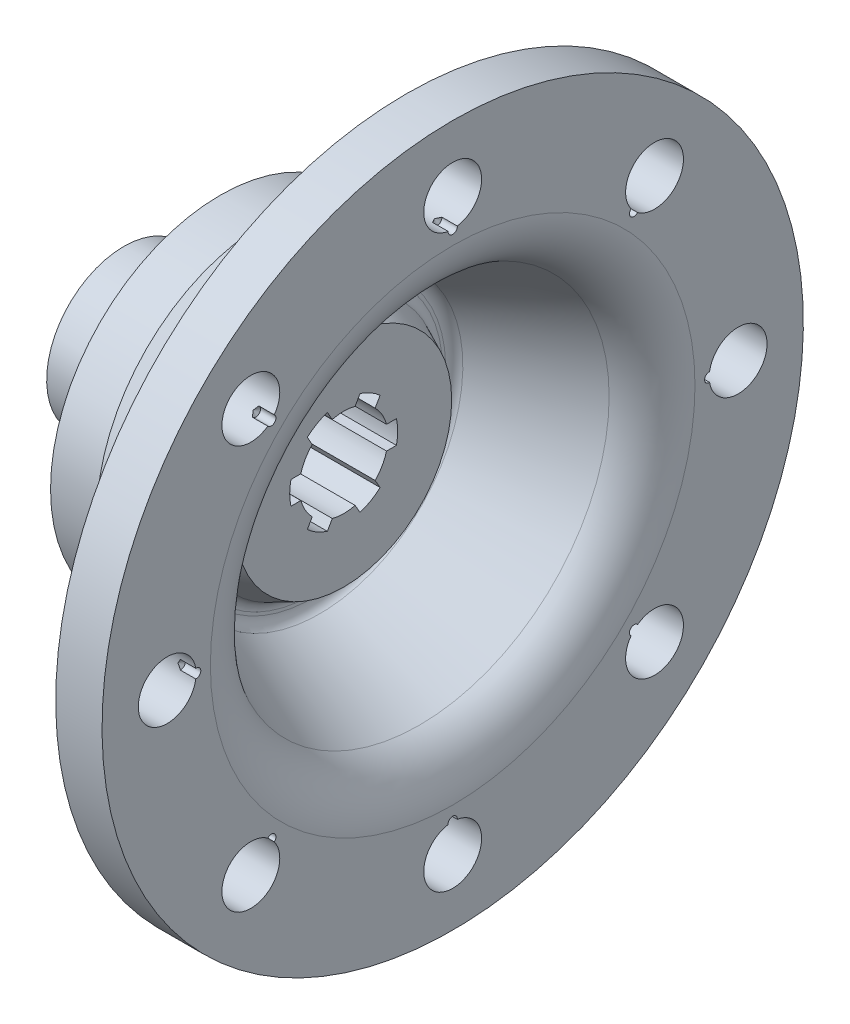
SolidWorks part; units mm, degrees
ref_plane "Face" through (0, 0, 0) normal (0, 0, 1) x (1, 0, 0)
ref_plane "Dessus" through (0, 0, 0) normal (0, 1, 0) x (1, 0, 0)
ref_plane "Droite" through (0, 0, 0) normal (1, 0, 0) x (0, 0, -1)
sketch "Esquisse1" plane through (0, 0, 0) normal (0, 0, 1) x (1, 0, 0)
  line L0 (0, 0) -> (0, 20)
  line L1 (0, 20) -> (15, 20)
  line L2 (15, 20) -> (15, 24)
  line L3 (15, 24) -> (25, 24)
  line L4 (25, 24) -> (25, 44)
  line L5 (25, 44) -> (37, 44)
  line L6 (37, 44) -> (73.2523, 60.9047)
  line L7 (73.2523, 60.9047) -> (73.2523, 90.9047)
  line L8 (73.2523, 90.9047) -> (85.2523, 90.9047)
  line L9 (85.2523, 90.9047) -> (85.2523, 53.2599)
  line L10 (85.2523, 53.2599) -> (49, 36.3552)
  line L11 (49, 36.3552) -> (49, 31.7305)
  line L12 (49, 31.7305) -> (57, 28)
  line L13 (57, 28) -> (57, 0)
  line L14 (57, 0) -> (0, 0)
  line L15 (49, 34.0428) -> (68.0279, 34.0428) construction
  dimension "D1" = 57
  dimension "D2" = 20
  dimension "D3" = 15
  dimension "D4" = 4
  dimension "D5" = 10
  dimension "D6" = 20
  dimension "D7" = 12
  dimension "D8" = 40
  dimension "D9" = 25
  dimension "D10" = 30
  dimension "D11" = 12
  dimension "D12" = 12
  dimension "D13" = 28
  dimension "D14" = 8
revolve "Révolution1" add sketch "Esquisse1" angle 360 about L14
sketch "Esquisse5" plane through (0, 0, 0) normal (-1, 0, 0) x (0, 0, 1)
  circle A0 centre (0, 0) radius 14
  dimension "D1" = 28
extrude "Enlèv. mat.-Extru.1" cut sketch "Esquisse5" against normal through all
hole_wizard "Trou taraudé M8x1.251" positions "Esquisse4" profile "Esquisse3" tap size "M8x1.25" standard "ISO"
sketch "Esquisse4" plane through (25, 0, 0) normal (-1, 0, 0) x (0, 0, 1)
  point P0 (0, 34)
  dimension "D1" = 34
sketch "Esquisse3" plane through (25, 34, 0) normal (0, 1, 0) x (0, 0, 1)
  line L0 (0, 0) -> (0, 20.7929)
  line L1 (0, 20.7929) -> (3.4, 18.75)
  line L2 (3.4, 18.75) -> (3.4, 15)
  line L3 (3.4, 15) -> (4, 15)
  line L4 (4, 15) -> (4, 0)
  line L5 (4, 0) -> (0, 0)
  line L10 (0, 20.7929) -> (-3.4, 18.75) construction
  line L11 (0, -6.35) -> (0, 107.95) construction
  dimension "Diamètre du trou pour taraudage" = 6.8
  dimension "Profondeur du trou pour taraudage" = 18.75
  dimension "Diamètre principal du filetage" = 8
  dimension "Profondeur du filetage" = 15
  dimension "Angle de pointe" = 118
sketch "Esquisse6" plane through (73.2523, 0, 0) normal (-1, 0, 0) x (0, 0, 1)
  line L0 (0, 0) -> (0, 74) construction
  circle A0 centre (0, 74) radius 12
  dimension "D2" = 24
  dimension "D1" = 74
extrude "Enlèv. mat.-Extru.2" cut sketch "Esquisse6" against normal blind 0.5
sketch "Esquisse7" plane through (73.7523, 0, 0) normal (-1, 0, 0) x (0, 0, 1)
  circle A0 centre (0, 74) radius 7.5
  dimension "D1" = 15
extrude "Enlèv. mat.-Extru.3" cut sketch "Esquisse7" against normal through all
hole_wizard "Dégagement M21" positions "Esquisse10" profile "Esquisse9" hole size "M2" standard "ISO"
sketch "Esquisse10" plane through (85.2523, 0, 0) normal (1, 0, 0) x (0, 0, -1)
  circle A0 centre (0, 74) radius 7.5 construction
  point P0 (0, 66.5)
sketch "Esquisse9" plane through (85.2523, 66.5, 0) normal (0, 1, 0) x (0, 0, -1)
  line L0 (0, 0) -> (0, 4.721)
  line L1 (0, 4.721) -> (1.2, 4)
  line L2 (1.2, 4) -> (1.2, 0)
  line L5 (1.2, 0) -> (0, 0)
  line L10 (0, 4.721) -> (-1.2, 4) construction
  line L11 (0, -6.35) -> (0, 107.95) construction
  dimension "Diamètre du perçage" = 2.4
  dimension "Profondeur du perçage" = 4
  dimension "Angle de pointe" = 118
pattern_circular "Répétition circulaire1" count 8 over 360 about axis through (0, 0, 0) along (1, 0, 0) of "Dégagement M21", "Enlèv. mat.-Extru.2", "Enlèv. mat.-Extru.3"
pattern_circular "Répétition circulaire2" count 8 over 360 about axis through (0, 0, 0) along (1, 0, 0) of "Trou taraudé M8x1.251"
fillet "Congé1" radius 3 3 edges at (73.2523, 60.9047, 0) (49, 31.7305, 0) (49, 36.3552, 0)
fillet "Congé2" radius 15 1 edges at (85.2523, 53.2599, 0)
sketch "Esquisse11" plane through (0, 0, 0) normal (-1, 0, 0) x (0, 0, 1)
  line L0 (0, 0) -> (14, 0) construction
  line L1 (13.6748, -3) -> (11.1018, -3)
  line L2 (9.4355, -10.3427) -> (8.149, -8.1144)
  line L3 (0, 0) -> (5.75, -9.9593) construction
  circle A0 centre (0, 0) radius 14 construction
  arc A1 (9.4355, -10.3427) -> (13.6748, -3) centre (0, 0) ccw
  arc A2 (8.149, -8.1144) -> (11.1018, -3) centre (0, 0) ccw
  dimension "D1" = 23
  dimension "D2" = 3
  dimension "D3" = 3
  dimension "D4" = 60
extrude "Extrusion1" add sketch "Esquisse11" against normal up to surface (57 mm away)
pattern_circular "Répétition circulaire3" count 6 over 360 about axis through (0, 0, 0) along (1, 0, 0) of "Extrusion1"
